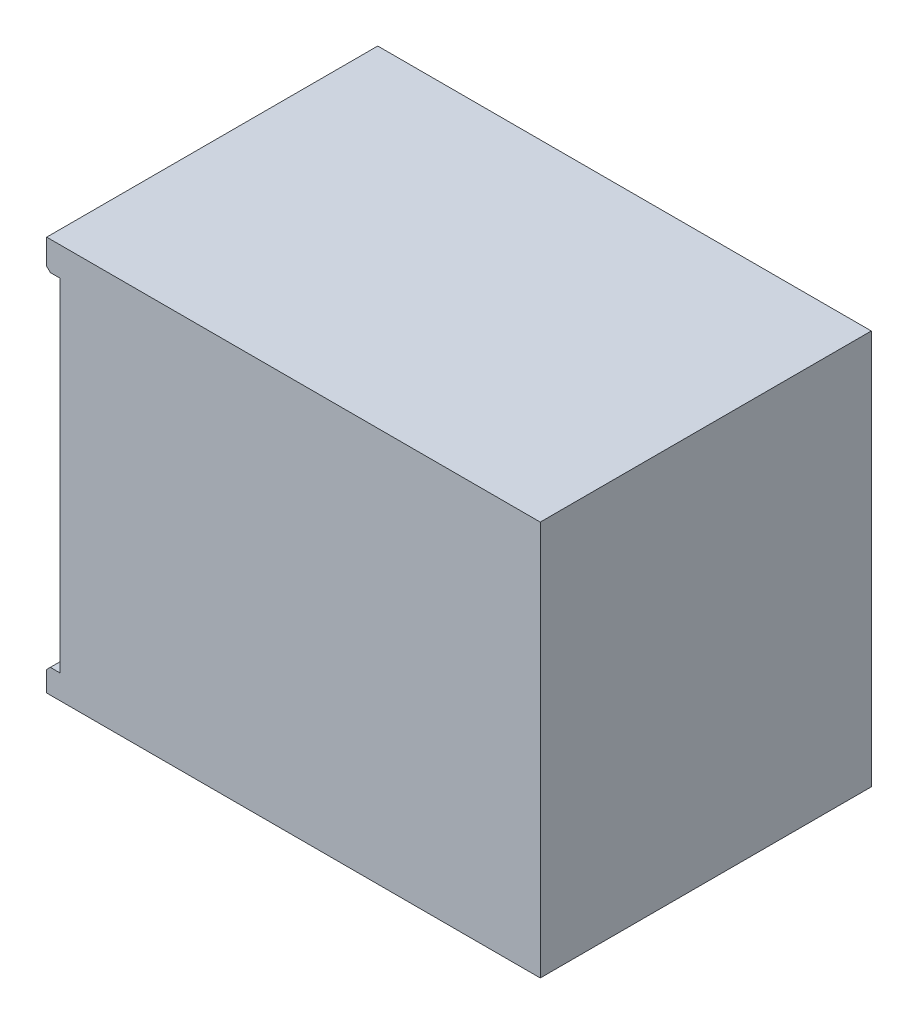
SolidWorks part; units mm, degrees
ref_plane "FRONT" through (0, 0, 0) normal (0, 0, 1) x (1, 0, 0)
ref_plane "TOP" through (0, 0, 0) normal (0, 1, 0) x (1, 0, 0)
ref_plane "RIGHT" through (0, 0, 0) normal (1, 0, 0) x (0, 0, -1)
sketch "Sketch1" plane through (0, 0, 0) normal (0, 0, 1) x (1, 0, 0)
  line L0 (50.673, 0) -> (50.673, -41.656)
  line L1 (50.673, -41.656) -> (-1.397, -41.656)
  line L2 (-1.397, -41.656) -> (-1.397, -39.116)
  line L3 (-1.397, -39.116) -> (0, -39.116)
  line L4 (0, -39.116) -> (0, -3.048)
  line L5 (0, -3.048) -> (-1.397, -3.048)
  line L6 (-1.397, -3.048) -> (-1.397, 0)
  line L7 (-1.397, 0) -> (50.673, 0)
  dimension "D1" = 52.07
  dimension "D2" = 50.673
  dimension "D3" = 3.048
  dimension "D4" = 2.54
  dimension "D5" = 41.656
extrude "Extrude1" add sketch "Sketch1" along normal mid plane 34.925
sketch "Sketch2" plane through (0, 0, 0) normal (-1, 0, 0) x (0, 0, 1)
  line L0 (0, 0) -> (0, -41.656) construction
  line L1 (17.4625, -41.656) -> (-17.4625, -41.656) construction
  line L2 (0, -20.828) -> (21.0733, -20.828) construction
  point P0 (-13.97, -29.21)
  point P1 (13.97, -12.446)
  dimension "D1" = 13.97
  dimension "D2" = 13.97
  dimension "D3" = 8.382
  dimension "D4" = 8.382
hole_wizard "#6-32 Tapped Hole1" positions "3DSketch1" profile "Sketch3" tap size "#6-32" standard "Ansi Inch"
sketch3d "3DSketch1"
  point P0 (0, -29.21, -13.97)
  point P3 (0, -12.446, 13.97)
sketch "Sketch3" plane through (0, -29.21, -13.97) normal (0, 1, 0) x (0, 0, 1)
  line L0 (0, 0) -> (0, 10.8101)
  line L1 (0, 10.8101) -> (1.3525, 9.9974)
  line L2 (1.3525, 9.9974) -> (1.3525, 7.62)
  line L3 (1.3525, 7.62) -> (1.7526, 7.62)
  line L4 (1.7526, 7.62) -> (1.7526, 0)
  line L5 (1.7526, 0) -> (0, 0)
  line L10 (0, 10.8101) -> (-1.3526, 9.9974) construction
  line L11 (0, -6.35) -> (0, 107.95) construction
  dimension "Tap Drill Dia." = 2.7051
  dimension "Tap Drill Depth" = 9.9974
  dimension "Thread Major Dia." = 3.5052
  dimension "Thread Depth" = 7.62
  dimension "Drill Angle" = 118
chamfer "Chamfer1" distance 0.381 angle 45 2 edges at (-1.397, -39.116, 0) (-1.397, -3.048, 0)
